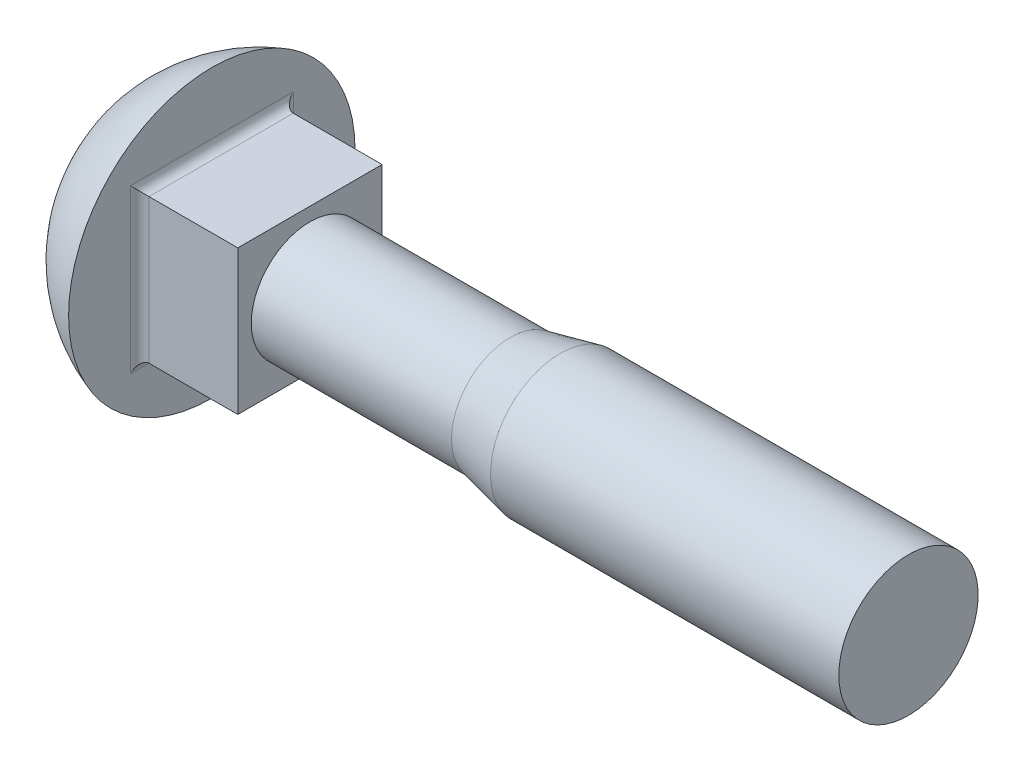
SolidWorks part; units mm, degrees
ref_plane "Front" through (0, 0, 0) normal (0, 0, 1) x (1, 0, 0)
ref_plane "Top" through (0, 0, 0) normal (0, 1, 0) x (1, 0, 0)
ref_plane "Right" through (0, 0, 0) normal (1, 0, 0) x (0, 0, -1)
sketch "Sketch1" plane through (0, 0, 0) normal (0, 0, 1) x (1, 0, 0)
  line L0 (-31.4843, 0) -> (38.6484, 0) construction
  line L1 (68.9, 0) -> (68.9, 6)
  line L2 (68.9, 6) -> (8.9, 6)
  line L3 (8.9, 6) -> (8.9, 12.3365)
  line L4 (68.9, 0) -> (0, 0)
  arc A0 (8.9, 12.3365) -> (0, 0) centre (13, 0) ccw
  dimension "r" = 13
  dimension "d" = 12
  dimension "l" = 60
  dimension "k" = 8.9
revolve "Base" add sketch "Sketch1" angle 360 about L0
ref_plane "Plane1" through (38.9, 0, 0) normal (1, 0, 0) x (0, 0, -1)
sketch "Sketch2" plane through (8.9, 0, 0) normal (1, 0, 0) x (0, 0, -1)
  line L1 (6.215, -6.215) -> (6.215, 6.215)
  line L2 (6.215, 6.215) -> (-6.215, 6.215)
  line L3 (-6.215, 6.215) -> (-6.215, -6.215)
  line L4 (-6.215, -6.215) -> (6.215, -6.215)
  circle A1 centre (0, 0) radius 6.215 construction
  dimension "Ss" = 12.43
extrude "Neck" add sketch "Sketch2" along normal blind 8.45
sketch "Sketch5" plane through (0, 0, 0) normal (0, 0, 1) x (1, 0, 0)
  line L0 (17.35, 5.053) -> (34.6, 5.053)
  line L1 (17.35, -6) -> (17.35, 6) construction
  line L2 (34.6, 5.053) -> (38.9, 6)
  line L3 (68.9, 6) -> (17.35, 6) construction
  line L4 (38.9, 6) -> (17.35, 6)
  line L5 (17.35, 6) -> (17.35, 5.053)
  line L6 (68.9, -6) -> (68.9, 6) construction
  line L7 (0, 0) -> (82.6115, 0) construction
  dimension "D1" = 30
  dimension "X" = 4.3
  dimension "D3" = 10.106
revolve "Cut-Revolve1" cut sketch "Sketch5" angle 360 about L7
fillet "HeadFillet" radius 0.8 4 edges at (8.9, 0, -6.215) (8.9, -6.215, 0) (8.9, 0, 6.215) (8.9, 6.215, 0)
sketch "Sketch4" plane through (0, 0, 0) normal (0, 0, 1) x (1, 0, 0)
  line L0 (68.6292, 6.2) -> (69.1707, 6.2)
  line L1 (69.1707, 6.2) -> (69.1707, 6)
  line L2 (69.1707, 6) -> (68.9, 5.531)
  line L3 (68.6292, 6) -> (68.9, 5.531)
  line L4 (68.6292, 6.2) -> (68.6292, 6)
  line L5 (-64.5053, 0) -> (64.5053, 0) construction
  line L6 (68.6292, 6) -> (69.1707, 6) construction
  line L7 (68.9, 6) -> (68.9, 5.531) construction
  line L8 (68.9, -6) -> (68.9, 6) construction
  point P5 (68.9, 6.2)
  dimension "D1" = 0.2
  dimension "D2" = 0.5415
  dimension "D3" = 12
revolve "Cut-Revolve10" [suppressed] cut sketch "Sketch4" angle 360 about L5
pattern_linear "LPattern10" [suppressed] count 73 spacing 0.704 along (1, 0, 0)
equation "\"D3@LPattern10\" = \"D2@Sketch4\" * 1.3"
equation "\"D1@LPattern10\" = (\"l@Sketch1\" - \"k1@Neck\"  )  / \"D3@LPattern10\""
equation "\"D3@Sketch5\" = \"D2@ThreadCosmetic1\""
equation "\"D1@Sketch5\" = \"b@Plane1\""
equation "\"D3@Sketch4\" = \"d@Sketch1\""
